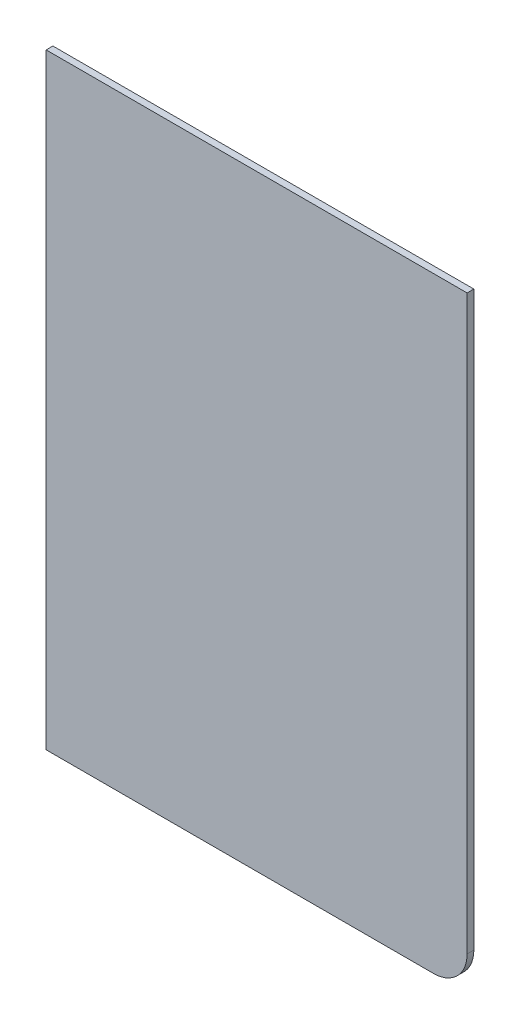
SolidWorks part; units mm, degrees
ref_plane "Plan de face" through (0, 0, 0) normal (0, 0, 1) x (1, 0, 0)
ref_plane "Plan de dessus" through (0, 0, 0) normal (0, 1, 0) x (1, 0, 0)
ref_plane "Plan de droite" through (0, 0, 0) normal (1, 0, 0) x (0, 0, -1)
sketch "Esquisse1" plane through (0, 0, 0) normal (0, 0, 1) x (1, 0, 0)
  line L1 (0, 0) -> (125, 0)
  line L2 (0, 0) -> (0, 180)
  line L3 (0, 180) -> (125, 180)
  line L4 (125, 0) -> (125, 180)
  dimension "D1" = 125
  dimension "D2" = 180
extrude "Extrusion1" add sketch "Esquisse1" along normal blind 2
fillet "Congé1" radius 10 1 edges at (125, 0, 1)
